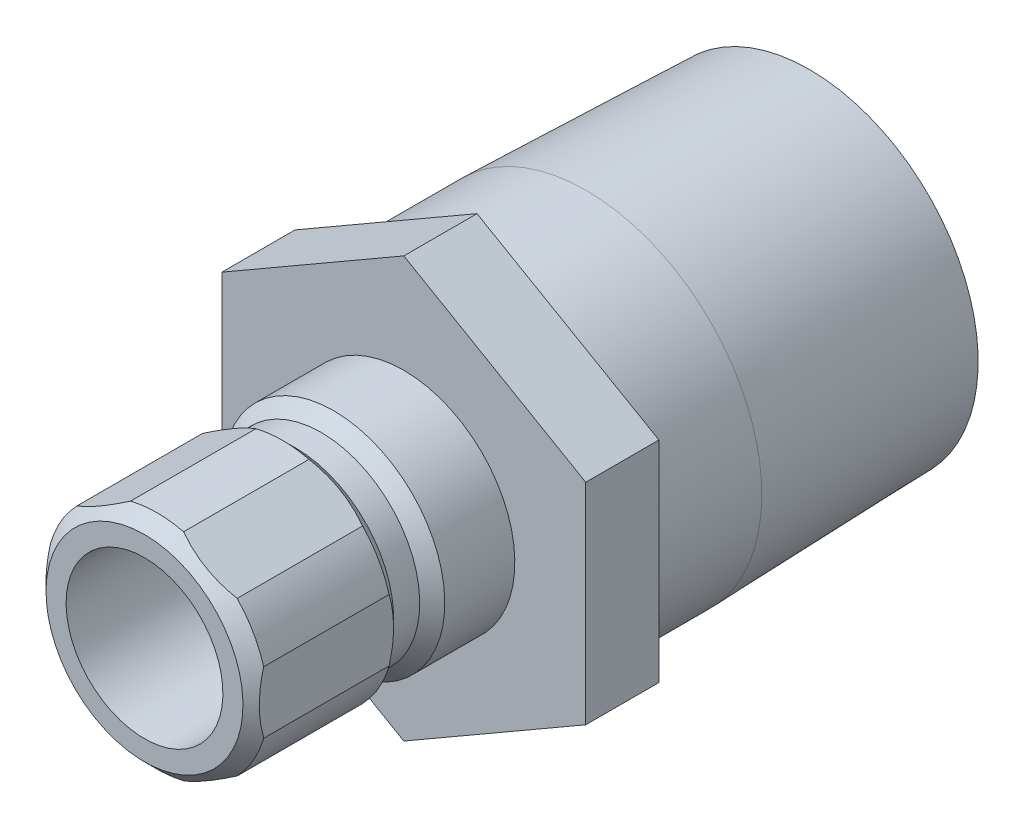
SolidWorks part; units mm, degrees
ref_plane "Front Plane" through (0, 0, 0) normal (0, 0, 1) x (1, 0, 0)
ref_plane "Top Plane" through (0, 0, 0) normal (0, 1, 0) x (1, 0, 0)
ref_plane "Right Plane" through (0, 0, 0) normal (1, 0, 0) x (0, 0, -1)
sketch "Sketch1" plane through (0, 0, 0) normal (1, 0, 0) x (0, 0, -1)
  line L0 (0, 0) -> (-18.923, 0) construction
  line L1 (-15.748, 4.7625) -> (-15.748, 5.9817)
  line L2 (-6.604, 5.9817) -> (-6.604, 0) construction
  line L3 (-14.986, 6.7437) -> (-7.366, 6.7437)
  line L4 (0, 10.668) -> (0, 0) construction
  line L5 (-6.604, 5.9817) -> (-5.0165, 5.9817)
  line L6 (-4.2545, 6.7437) -> (0, 6.7437)
  line L7 (0, 6.7437) -> (0, 10.668)
  line L8 (-6.604, 5.9817) -> (-7.366, 6.7437)
  line L9 (-5.0165, 5.9817) -> (-4.2545, 6.7437)
  line L10 (-15.748, 5.9817) -> (-14.986, 6.7437)
  line L11 (-15.748, 4.7625) -> (1.524, 4.7625)
  line L12 (0, 10.668) -> (11.0744, 10.668)
  line L13 (11.0744, 10.668) -> (24.638, 10.2441)
  line L14 (24.638, 10.2441) -> (24.638, 7.8994)
  line L15 (0, 0) -> (4.445, 0) construction
  line L17 (3.1919, 7.8994) -> (24.638, 7.8994)
  line L18 (1.524, 4.7625) -> (3.1919, 7.8994)
  dimension "D1" = 15.748
  dimension "D2" = 1.5875
  dimension "D3" = 0.762
  dimension "D4" = 45
  dimension "D5" = 9.144
  dimension "D6" = 45
  dimension "D7" = 1.79
  dimension "D8" = 13.5636
  dimension "D9" = 40.386
  dimension "D10" = 3.175
  dimension "D11" = 9.525
  dimension "D12" = 21.336
  dimension "D13" = 4.445
  dimension "D14" = 13.4874
  dimension "D15" = 15.7988
  dimension "D16" = 17.272
  dimension "D17" = 118
revolve "Revolve1" add sketch "Sketch1" angle 360 about L0
sketch "Sketch2" plane through (0, 0, 0) normal (0, 0, 1) x (1, 0, 0)
  line L1 (-11.049, 6.3791) -> (-11.049, -6.3791)
  line L2 (-11.049, -6.3791) -> (0, -12.7583)
  line L3 (0, -12.7583) -> (11.049, -6.3791)
  line L4 (11.049, -6.3791) -> (11.049, 6.3791)
  line L5 (11.049, 6.3791) -> (0, 12.7583)
  line L6 (0, 12.7583) -> (-11.049, 6.3791)
  circle A0 centre (0, 0) radius 11.049 construction
  circle A1 centre (0, 0) radius 7.8994 construction
  circle A2 centre (0, 0) radius 7.8994
  dimension "D1" = 22.098
extrude "Boss-Extrude1" add sketch "Sketch2" against normal up to vertex (4.445 mm away)
sketch "Sketch3" plane through (0, 0, 0) normal (0, 0, 1) x (1, 0, 0)
  line L1 (-6.477, 3.7395) -> (-6.477, -3.7395)
  line L2 (-6.477, -3.7395) -> (0, -7.479)
  line L3 (0, -7.479) -> (6.477, -3.7395)
  line L4 (6.477, -3.7395) -> (6.477, 3.7395)
  line L5 (6.477, 3.7395) -> (0, 7.479)
  line L6 (0, 7.479) -> (-6.477, 3.7395)
  circle A0 centre (0, 0) radius 6.477 construction
  dimension "D1" = 12.954
extrude "Cut-Extrude1" cut sketch "Sketch3" along normal through all from vertex at 6.604 flip side to cut
